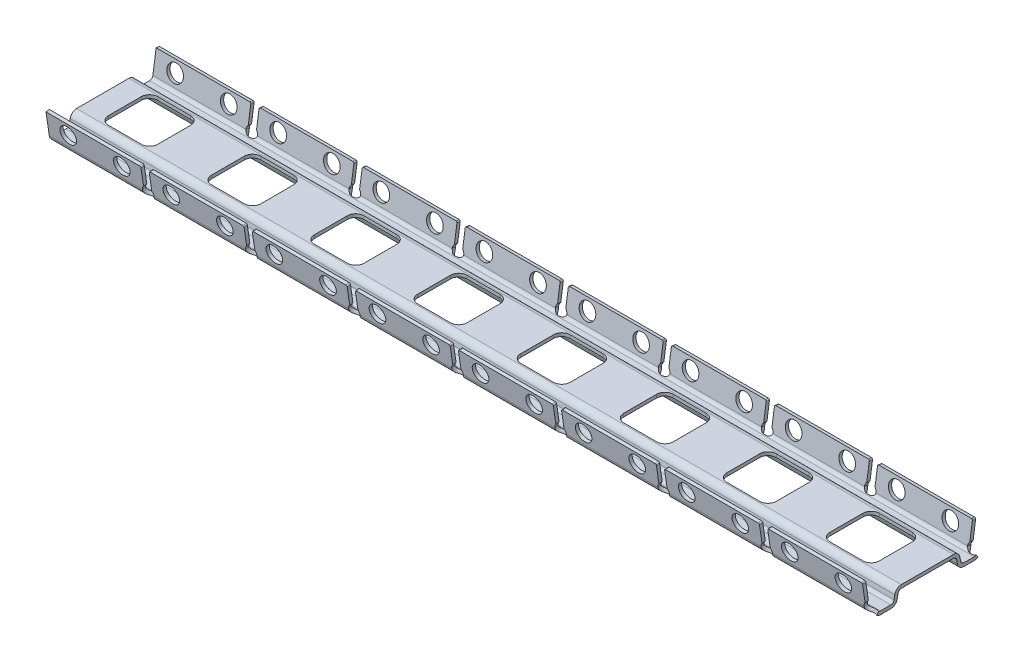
SolidWorks part; units mm, degrees
ref_plane "Front Plane" through (0, 0, 0) normal (0, 0, 1) x (1, 0, 0)
ref_plane "Top Plane" through (0, 0, 0) normal (0, 1, 0) x (1, 0, 0)
ref_plane "Right Plane" through (0, 0, 0) normal (1, 0, 0) x (0, 0, -1)
imported_body "Imported3"
sketch "Sketch1" plane through (0, 1.2354, 0.1817) normal (0, 0.9894, 0.1455) x (-1, 0, 0)
  line L0 (100, 12.2508) -> (77, 12.2508)
  line L1 (77, 12.2508) -> (77, 13.0508)
  line L2 (77, 13.0508) -> (100, 13.0508)
  line L3 (100, 13.0508) -> (100, 12.2508)
extrude "Boss-Extrude1" add sketch "Sketch1" along normal blind 4.5114
sketch "Sketch2" plane through (0, 1.2354, -0.1817) normal (0, 0.9894, -0.1455) x (-1, 0, 0)
  line L0 (100, -12.2508) -> (100, -13.0508)
  line L1 (100, -13.0508) -> (77, -13.0508)
  line L2 (77, -13.0508) -> (77, -12.2508)
  line L3 (77, -12.2508) -> (100, -12.2508)
extrude "Boss-Extrude2" add sketch "Sketch2" along normal blind 4.5114
sketch "Sketch3" plane through (0, 1.2354, -0.1817) normal (0, 0.9894, -0.1455) x (-1, 0, 0)
  line L0 (-75, -13.0508) -> (-98, -13.0508)
  line L1 (-98, -13.0508) -> (-98, -12.2508)
  line L2 (-98, -12.2508) -> (-75, -12.2508)
  line L3 (-75, -12.2508) -> (-75, -13.0508)
extrude "Boss-Extrude3" add sketch "Sketch3" along normal blind 4.5114
sketch "Sketch4" plane through (0, 1.2354, -0.1817) normal (0, 0.9894, -0.1455) x (-1, 0, 0)
  line L0 (-73, -12.2508) -> (-50, -12.2508)
  line L1 (-50, -12.2508) -> (-50, -13.0508)
  line L2 (-50, -13.0508) -> (-73, -13.0508)
  line L3 (-73, -13.0508) -> (-73, -12.2508)
extrude "Boss-Extrude4" add sketch "Sketch4" along normal blind 4.5114
sketch "Sketch5" plane through (0, 1.2354, -0.1817) normal (0, 0.9894, -0.1455) x (-1, 0, 0)
  line L0 (-25, -13.0508) -> (-48, -13.0508)
  line L1 (-48, -13.0508) -> (-48, -12.2508)
  line L2 (-48, -12.2508) -> (-25, -12.2508)
  line L3 (-25, -12.2508) -> (-25, -13.0508)
extrude "Boss-Extrude5" add sketch "Sketch5" along normal blind 4.5114
sketch "Sketch6" plane through (0, 1.2354, -0.1817) normal (0, 0.9894, -0.1455) x (-1, 0, 0)
  line L0 (0, -13.0508) -> (-23, -13.0508)
  line L1 (-23, -13.0508) -> (-23, -12.2508)
  line L2 (-23, -12.2508) -> (0, -12.2508)
  line L3 (0, -12.2508) -> (0, -13.0508)
extrude "Boss-Extrude6" add sketch "Sketch6" along normal blind 4.5114
sketch "Sketch7" plane through (0, 1.2354, -0.1817) normal (0, 0.9894, -0.1455) x (-1, 0, 0)
  line L0 (25, -13.0508) -> (2, -13.0508)
  line L1 (2, -13.0508) -> (2, -12.2508)
  line L2 (2, -12.2508) -> (25, -12.2508)
  line L3 (25, -12.2508) -> (25, -13.0508)
extrude "Boss-Extrude7" add sketch "Sketch7" along normal blind 4.5114
sketch "Sketch8" plane through (0, 1.2354, 0.1817) normal (0, 0.9894, 0.1455) x (-1, 0, 0)
  line L0 (-50, 12.2508) -> (-73, 12.2508)
  line L1 (-73, 12.2508) -> (-73, 13.0508)
  line L2 (-73, 13.0508) -> (-50, 13.0508)
  line L3 (-50, 13.0508) -> (-50, 12.2508)
extrude "Boss-Extrude8" add sketch "Sketch8" along normal blind 4.5114
sketch "Sketch9" plane through (0, 1.2354, 0.1817) normal (0, 0.9894, 0.1455) x (-1, 0, 0)
  line L0 (-98, 13.0508) -> (-75, 13.0508)
  line L1 (-75, 13.0508) -> (-75, 12.2508)
  line L2 (-75, 12.2508) -> (-98, 12.2508)
  line L3 (-98, 12.2508) -> (-98, 13.0508)
extrude "Boss-Extrude9" add sketch "Sketch9" along normal blind 4.5114
sketch "Sketch10" plane through (0, 1.2354, 0.1817) normal (0, 0.9894, 0.1455) x (-1, 0, 0)
  line L0 (75, 12.2508) -> (52, 12.2508)
  line L1 (52, 12.2508) -> (52, 13.0508)
  line L2 (52, 13.0508) -> (75, 13.0508)
  line L3 (75, 13.0508) -> (75, 12.2508)
extrude "Boss-Extrude10" add sketch "Sketch10" along normal blind 4.5114
sketch "Sketch11" plane through (0, 1.2354, 0.1817) normal (0, 0.9894, 0.1455) x (-1, 0, 0)
  line L0 (50, 12.2508) -> (27, 12.2508)
  line L1 (27, 12.2508) -> (27, 13.0508)
  line L2 (27, 13.0508) -> (50, 13.0508)
  line L3 (50, 13.0508) -> (50, 12.2508)
extrude "Boss-Extrude11" add sketch "Sketch11" along normal blind 4.5114
sketch "Sketch12" plane through (0, 1.2354, 0.1817) normal (0, 0.9894, 0.1455) x (-1, 0, 0)
  line L0 (2, 13.0508) -> (25, 13.0508)
  line L1 (25, 13.0508) -> (25, 12.2508)
  line L2 (25, 12.2508) -> (2, 12.2508)
  line L3 (2, 12.2508) -> (2, 13.0508)
extrude "Boss-Extrude12" add sketch "Sketch12" along normal blind 4.5114
sketch "Sketch13" plane through (0, 1.2354, 0.1817) normal (0, 0.9894, 0.1455) x (-1, 0, 0)
  line L0 (-23, 13.0508) -> (0, 13.0508)
  line L1 (0, 13.0508) -> (0, 12.2508)
  line L2 (0, 12.2508) -> (-23, 12.2508)
  line L3 (-23, 12.2508) -> (-23, 13.0508)
extrude "Boss-Extrude13" add sketch "Sketch13" along normal blind 4.5114
sketch "Sketch14" plane through (0, 1.2354, 0.1817) normal (0, 0.9894, 0.1455) x (-1, 0, 0)
  line L0 (-25, 12.2508) -> (-48, 12.2508)
  line L1 (-48, 12.2508) -> (-48, 13.0508)
  line L2 (-48, 13.0508) -> (-25, 13.0508)
  line L3 (-25, 13.0508) -> (-25, 12.2508)
extrude "Boss-Extrude14" add sketch "Sketch14" along normal blind 4.5114
sketch "Sketch15" plane through (0, 1.2354, -0.1817) normal (0, 0.9894, -0.1455) x (-1, 0, 0)
  line L0 (75, -13.0508) -> (52, -13.0508)
  line L1 (52, -13.0508) -> (52, -12.2508)
  line L2 (52, -12.2508) -> (75, -12.2508)
  line L3 (75, -12.2508) -> (75, -13.0508)
extrude "Boss-Extrude15" add sketch "Sketch15" along normal blind 4.5114
sketch "Sketch16" plane through (0, 1.2354, -0.1817) normal (0, 0.9894, -0.1455) x (-1, 0, 0)
  line L0 (27, -12.2508) -> (50, -12.2508)
  line L1 (50, -12.2508) -> (50, -13.0508)
  line L2 (50, -13.0508) -> (27, -13.0508)
  line L3 (27, -13.0508) -> (27, -12.2508)
extrude "Boss-Extrude16" add sketch "Sketch16" along normal blind 4.5114
sketch "Sketch17" plane through (0, -2.2, 0) normal (0, 1, 0) x (-1, 0, 0)
  line L0 (-100, -7.6777) -> (-100, 7.6777)
  line L1 (-100, 7.6777) -> (100, 7.6777)
  line L2 (100, 7.6777) -> (100, -7.6777)
  line L3 (100, -7.6777) -> (-100, -7.6777)
extrude "Boss-Extrude17" add sketch "Sketch17" along normal blind 3
sketch "Sketch18" plane through (-100, 0, 0) normal (-1, 0, 0) x (0, 0, 1)
  line L0 (-7, -3) -> (7, -3)
  line L1 (7, -3) -> (7, 0)
  line L2 (7, 0) -> (-7, 0)
  line L3 (-7, 0) -> (-7, -3)
extrude "Cut-Extrude1" cut sketch "Sketch18" against normal through all
sketch "Sketch19" plane through (0, 0.8, 0) normal (0, 1, 0) x (-1, 0, 0)
  line L0 (-92.3543, 6) -> (-92.3543, -6)
  line L1 (-92.3543, -6) -> (-80.3543, -6)
  line L2 (-80.3543, -6) -> (-80.3543, 6)
  line L3 (-80.3543, 6) -> (-92.3543, 6)
extrude "Cut-Extrude2" cut sketch "Sketch19" against normal through all
sketch "Sketch20" plane through (0, 0.8, 0) normal (0, 1, 0) x (-1, 0, 0)
  line L0 (-67.3543, 6) -> (-67.3543, -6)
  line L1 (-67.3543, -6) -> (-55.3543, -6)
  line L2 (-55.3543, -6) -> (-55.3543, 6)
  line L3 (-55.3543, 6) -> (-67.3543, 6)
extrude "Cut-Extrude3" cut sketch "Sketch20" against normal through all
sketch "Sketch21" plane through (0, 0.8, 0) normal (0, 1, 0) x (-1, 0, 0)
  line L0 (-42.3543, 6) -> (-42.3543, -6)
  line L1 (-42.3543, -6) -> (-30.3543, -6)
  line L2 (-30.3543, -6) -> (-30.3543, 6)
  line L3 (-30.3543, 6) -> (-42.3543, 6)
extrude "Cut-Extrude4" cut sketch "Sketch21" against normal through all
sketch "Sketch22" plane through (0, 0.8, 0) normal (0, 1, 0) x (-1, 0, 0)
  line L0 (-17.3543, 6) -> (-17.3543, -6)
  line L1 (-17.3543, -6) -> (-5.3543, -6)
  line L2 (-5.3543, -6) -> (-5.3543, 6)
  line L3 (-5.3543, 6) -> (-17.3543, 6)
extrude "Cut-Extrude5" cut sketch "Sketch22" against normal through all
sketch "Sketch23" plane through (0, 0.8, 0) normal (0, 1, 0) x (-1, 0, 0)
  line L0 (7.6457, 6) -> (7.6457, -6)
  line L1 (7.6457, -6) -> (19.6457, -6)
  line L2 (19.6457, -6) -> (19.6457, 6)
  line L3 (19.6457, 6) -> (7.6457, 6)
extrude "Cut-Extrude6" cut sketch "Sketch23" against normal through all
sketch "Sketch24" plane through (0, 0.8, 0) normal (0, 1, 0) x (-1, 0, 0)
  line L0 (32.6457, 6) -> (32.6457, -6)
  line L1 (32.6457, -6) -> (44.6457, -6)
  line L2 (44.6457, -6) -> (44.6457, 6)
  line L3 (44.6457, 6) -> (32.6457, 6)
extrude "Cut-Extrude7" cut sketch "Sketch24" against normal through all
sketch "Sketch25" plane through (0, 0.8, 0) normal (0, 1, 0) x (-1, 0, 0)
  line L0 (82.6457, 6) -> (82.6457, -6)
  line L1 (82.6457, -6) -> (94.6457, -6)
  line L2 (94.6457, -6) -> (94.6457, 6)
  line L3 (94.6457, 6) -> (82.6457, 6)
extrude "Cut-Extrude8" cut sketch "Sketch25" against normal through all
sketch "Sketch26" plane through (0, 0, 0) normal (0, -1, 0) x (1, 0, 0)
  line L0 (-57.6457, -6) -> (-57.6457, 6)
  line L1 (-57.6457, 6) -> (-69.6457, 6)
  line L2 (-69.6457, 6) -> (-69.6457, -6)
  line L3 (-69.6457, -6) -> (-57.6457, -6)
extrude "Cut-Extrude9" cut sketch "Sketch26" against normal through all
draft "Draft1" type of draft neutral plane draft angle 9.462 faces to draft 2 parameters "D1"=9.462
draft "Draft2" type of draft neutral plane draft angle 9.462 faces to draft 2 parameters "D1"=9.462
hole_wizard "Ø4.0 (4) Diameter Hole1" positions "Sketch28" profile "Sketch27" hole size "Ø4.0" standard "ANSI Metric"
sketch "Sketch28" plane through (0, -1.7824, -12.1205) normal (0, 0.1455, 0.9894) x (1, 0, 0)
  point P0 (-20, 3.0893)
  point P1 (-7, 3.0893)
  point P2 (18, 3.0893)
  point P3 (5, 3.0893)
  point P4 (43, 3.0893)
  point P5 (30, 3.0893)
  point P6 (68, 3.0893)
  point P7 (55, 3.0893)
  point P8 (80, 3.0893)
  point P9 (93, 3.0893)
  point P10 (-82, 3.0893)
  point P11 (-95, 3.0893)
  point P12 (-57, 3.0893)
  point P13 (-70, 3.0893)
  point P14 (-32, 3.0893)
  point P15 (-45, 3.0893)
sketch "Sketch27" plane through (-20, 1.274, -12.5699) normal (1, 0, 0) x (0, -0.9894, 0.1455)
  line L0 (0, 0) -> (0, 1.7894)
  line L1 (0, 1.7894) -> (2, 1.7894)
  line L2 (2, 1.7894) -> (2, 0)
  line L5 (2, 0) -> (0, 0)
  line L11 (0, -6.35) -> (0, 107.95) construction
  dimension "Thru Hole Dia." = 4
  dimension "Thru Hole Depth" = 1.7894
hole_wizard "Ø4.0 (4) Diameter Hole2" positions "Sketch30" profile "Sketch29" hole size "Ø4.0" standard "ANSI Metric"
sketch "Sketch30" plane through (0, -1.7824, 12.1205) normal (0, 0.1455, -0.9894) x (-1, 0, 0)
  point P0 (-43, 3.0893)
  point P1 (-30, 3.0893)
  point P2 (-18, 3.0893)
  point P3 (-5, 3.0893)
  point P4 (7, 3.0893)
  point P5 (20, 3.0893)
  point P6 (32, 3.0893)
  point P7 (45, 3.0893)
  point P8 (57, 3.0893)
  point P9 (70, 3.0893)
  point P10 (95, 3.0893)
  point P11 (82, 3.0893)
  point P12 (-93, 3.0893)
  point P13 (-80, 3.0893)
  point P14 (-68, 3.0893)
  point P15 (-55, 3.0893)
sketch "Sketch29" plane through (43, 1.274, 12.5699) normal (1, 0, 0) x (0, 0.9894, 0.1455)
  line L0 (0, 0) -> (0, 1.7894)
  line L1 (0, 1.7894) -> (2, 1.7894)
  line L2 (2, 1.7894) -> (2, 0)
  line L5 (2, 0) -> (0, 0)
  line L11 (0, -6.35) -> (0, 107.95) construction
  dimension "Thru Hole Dia." = 4
  dimension "Thru Hole Depth" = 1.7894
fillet "Fillet1" radius 0.2913 30 edges at (50, 3.8582, -13.3543) (-75, 3.8582, 13.3543) (-75, 3.8582, -13.3543) (98, 3.8582, 13.3543) (48, 3.8582, -13.3543) (-2, 3.8582, 13.3543) (98, 3.8582, -13.3543) (75, 3.8582, 13.3543) (-27, 3.8582, -13.3543) (-25, 3.8582, 13.3543) (48, 3.8582, 13.3543) (-50, 3.8582, 13.3543) (73, 3.8582, -13.3543) (50, 3.8582, 13.3543) (75, 3.8582, -13.3543) (73, 3.8582, 13.3543) (-77, 3.8582, -13.3543) (-25, 3.8582, -13.3543) (-52, 3.8582, -13.3543) (23, 3.8582, 13.3543) (-50, 3.8582, -13.3543) (-27, 3.8582, 13.3543) (-52, 3.8582, 13.3543) (0, 3.8582, 13.3543) (-77, 3.8582, 13.3543) (25, 3.8582, -13.3543) (-2, 3.8582, -13.3543) (25, 3.8582, 13.3543) (0, 3.8582, -13.3543) (23, 3.8582, -13.3543)
fillet "Fillet2" radius 0.8 5 edges at (0, -2.2, -8.1777) (0, 0, -7) (86.4776, -2.2, 12.059) (0, 0, 7) (0, -2.2, 8.1777)
fillet "Fillet3" radius 1.6 66 edges at (-88.5479, -3, 12.75) (0, 0.8, -7.6777) (0, 0.8, 7.6777) (0, -3, 7.5) (0, -3, -7.5) (97.7575, -2.3917, -12.8395) (61.5095, -3, -12.75) (36.5095, -3, -12.75) (11.5095, -3, -12.75) (-13.4905, -3, -12.75) (-38.4905, -3, -12.75) (-63.4905, -3, -12.75) (-88.5384, -3, -12.75) (86.5135, -3, -12.75) (98.6839, -3, -11.8383) (-76.1456, -3, -11.7983) (-51.1456, -3, -11.7983) (-26.1456, -3, -11.7983) (-1.1456, -3, -11.7983) (23.8544, -3, -11.7983) (48.8544, -3, -11.7983) (73.8544, -3, -11.7983) (-63.5095, -3, 12.75) (-38.5095, -3, 12.75) (-13.5095, -3, 12.75) (11.4905, -3, 12.75) (36.4905, -3, 12.75) (61.4905, -3, 12.75) (86.4776, -3, 12.75) (97.7046, -2.3708, 12.8425) (98.761, -3, 11.8175) (74.1456, -3, 11.7983) (49.1456, -3, 11.7983) (24.1456, -3, 11.7983) (-0.8544, -3, 11.7983) (-25.8544, -3, 11.7983) (-50.8544, -3, 11.7983) (-75.8544, -3, 11.7983)
fillet "Fillet4" radius 2 32 edges at (80.3543, 0.4, 6) (30.3543, 0.4, 6) (5.3543, 0.4, 6) (-57.6457, 0.4, -6) (55.3543, 0.4, 6) (-57.6457, 0.4, 6) (17.3543, 0.4, -6) (-69.6457, 0.4, 6) (42.3543, 0.4, -6) (-69.6457, 0.4, -6) (67.3543, 0.4, -6) (-82.6457, 0.4, -6) (92.3543, 0.4, -6) (-82.6457, 0.4, 6) (-19.6457, 0.4, -6) (-94.6457, 0.4, 6) (17.3543, 0.4, 6) (-94.6457, 0.4, -6) (5.3543, 0.4, -6) (-32.6457, 0.4, -6) (42.3543, 0.4, 6) (-32.6457, 0.4, 6) (30.3543, 0.4, -6) (-44.6457, 0.4, 6) (67.3543, 0.4, 6) (-44.6457, 0.4, -6) (55.3543, 0.4, -6) (80.3543, 0.4, -6) (92.3543, 0.4, 6) (-7.6457, 0.4, 6) (-19.6457, 0.4, 6) (-7.6457, 0.4, -6)
